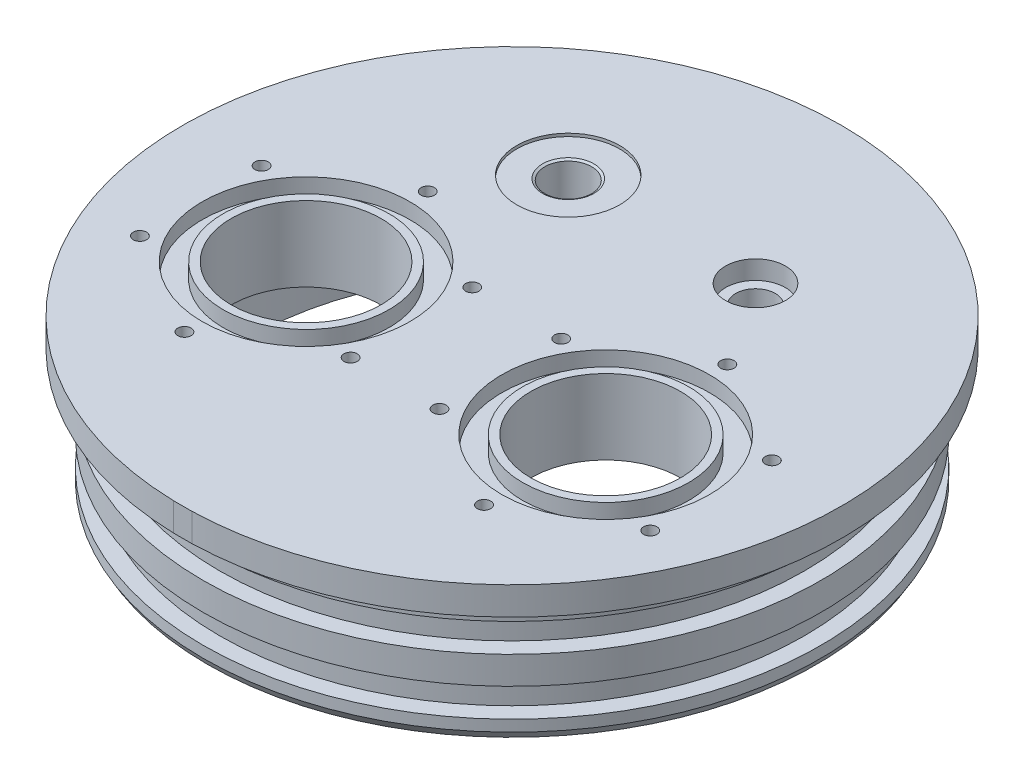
SolidWorks part; units mm, degrees
ref_plane "Front Plane" through (0, 0, 0) normal (0, 0, 1) x (1, 0, 0)
ref_plane "Top Plane" through (0, 0, 0) normal (0, 1, 0) x (1, 0, 0)
ref_plane "Right Plane" through (0, 0, 0) normal (1, 0, 0) x (0, 0, -1)
sketch "Sketch3" plane through (0, 0, 0) normal (0, 0, 1) x (1, 0, 0)
  line L0 (0, 0) -> (0, 25.4) construction
  line L1 (0, 0) -> (52.3621, 0)
  line L2 (52.3621, 0) -> (52.3621, 20.6502)
  line L3 (52.3621, 20.6502) -> (55.88, 20.6502)
  line L4 (55.88, 20.6502) -> (55.88, 25.4)
  line L5 (55.88, 25.4) -> (0, 25.4)
  line L6 (0, 0) -> (0, 25.4)
  dimension "D1" = 25.4
  dimension "D2" = 52.3621
  dimension "D3" = 55.88
  dimension "D4" = 4.7498
revolve "Revolve1" add sketch "Sketch3" angle 360 about L0
sketch "Sketch4" plane through (0, 0, 0) normal (0, -1, 0) x (1, 0, 0)
  circle A0 centre (0, 0) radius 49.5681
  dimension "D1" = 99.1362
extrude "Cut-Extrude1" cut sketch "Sketch4" against normal blind 4.826 from offset 12.7 flip side to cut
sketch "Sketch5" plane through (0, 0, 0) normal (0, -1, 0) x (1, 0, 0)
  circle A0 centre (0, 0) radius 49.5681
  dimension "D1" = 99.1362
extrude "Cut-Extrude2" cut sketch "Sketch5" against normal blind 4.826 from offset 3.175 flip side to cut
chamfer "Chamfer1" distance 1.27 angle 30 1 edges at (0, 0, -52.3621)
sketch "Sketch6" plane through (0, 25.4, 0) normal (0, 1, 0) x (1, 0, 0)
  circle A0 centre (25.4, -9.525) radius 12.7
  circle A1 centre (-25.4, -9.525) radius 12.7
  dimension "D1" = 25.4
  dimension "D2" = 25.4
  dimension "D3" = 25.4
  dimension "D4" = 9.525
  dimension "D5" = 25.4
  dimension "D6" = 9.525
extrude "Cut-Extrude3" cut sketch "Sketch6" against normal through all
sketch "Sketch7" plane through (0, 0, 0) normal (0, -1, 0) x (1, 0, 0)
  circle A0 centre (0, 0) radius 44.45
  dimension "D1" = 88.9
extrude "Cut-Extrude4" cut sketch "Sketch7" against normal blind 12.7
sketch "Sketch8" plane through (0, 25.4, 0) normal (0, 1, 0) x (1, 0, 0)
  circle A0 centre (-25.4, -9.525) radius 14.0843
  circle A1 centre (-25.4, -9.525) radius 17.6149
  dimension "D1" = 28.1686
  dimension "D2" = 35.2298
extrude "Cut-Extrude5" cut sketch "Sketch8" against normal blind 2.6416
sketch "Sketch9" plane through (0, 25.4, 0) normal (0, 1, 0) x (1, 0, 0)
  circle A0 centre (25.4, -9.525) radius 14.0843
  circle A1 centre (25.4, -9.525) radius 17.6149
  dimension "D1" = 28.1686
  dimension "D2" = 35.2298
extrude "Cut-Extrude6" cut sketch "Sketch9" against normal blind 2.6416
sketch "Sketch10" plane through (0, 25.4, 0) normal (0, 1, 0) x (1, 0, 0)
  circle A0 centre (-25.4, 11.0998) radius 1.1303
  circle A1 centre (-25.4, -9.525) radius 12.7 construction
  dimension "D1" = 2.2606
  dimension "D2" = 20.6248
extrude "Cut-Extrude7" cut sketch "Sketch10" against normal blind 9.525
pattern_circular "CirPattern1" count 6 over 360 about axis through (-25.4, 0, 9.525) along (0, 1, 0) of "Cut-Extrude7"
sketch "Sketch12" plane through (0, 25.4, 0) normal (0, 1, 0) x (1, 0, 0)
  circle A0 centre (25.4, 11.0998) radius 1.1303
  dimension "D2" = 2.2606
  dimension "D1" = 20.6248
extrude "Cut-Extrude8" cut sketch "Sketch12" against normal blind 9.525
pattern_circular "CirPattern2" count 6 over 360 about axis through (25.4, 0, 9.525) along (0, 1, 0) of "Cut-Extrude8"
sketch "Sketch14" plane through (0, 25.4, 0) normal (0, 1, 0) x (1, 0, 0)
  circle A0 centre (15.875, 25.4) radius 3.3655
  dimension "D1" = 6.731
  dimension "D2" = 25.4
  dimension "D3" = 15.875
extrude "Cut-Extrude10" cut sketch "Sketch14" against normal through all
sketch "Sketch15" plane through (0, 25.4, 0) normal (0, 1, 0) x (1, 0, 0)
  circle A0 centre (15.875, 25.4) radius 5.08
  dimension "D1" = 10.16
extrude "Cut-Extrude11" cut sketch "Sketch15" against normal blind 3.175
sketch "Sketch16" plane through (0, 25.4, 0) normal (0, 1, 0) x (1, 0, 0)
  circle A0 centre (-15.875, 25.4) radius 3.9624
  dimension "D1" = 7.9248
  dimension "D2" = 25.4
  dimension "D3" = 15.875
extrude "Cut-Extrude12" cut sketch "Sketch16" against normal through all
chamfer "Chamfer2" distance 1.27 angle 30 1 edges at (-15.875, 25.4, -21.4376)
sketch "Sketch17" plane through (0, 25.4, 0) normal (0, 1, 0) x (1, 0, 0)
  circle A0 centre (-15.875, 25.4) radius 8.7249
  dimension "D1" = 17.4498
extrude "Cut-Extrude13" cut sketch "Sketch17" against normal blind 0.508
sketch "Sketch18" plane through (0, 25.4, 0) normal (0, 1, 0) x (1, 0, 0)
  line L0 (-1.5748, -55.8578) -> (1.5748, -55.8578)
  circle A0 centre (0, 0) radius 55.88 construction
  dimension "D1" = 1.5748
extrude "Cut-Extrude14" cut sketch "Sketch18" against normal through all and the other way through all flip side to cut
